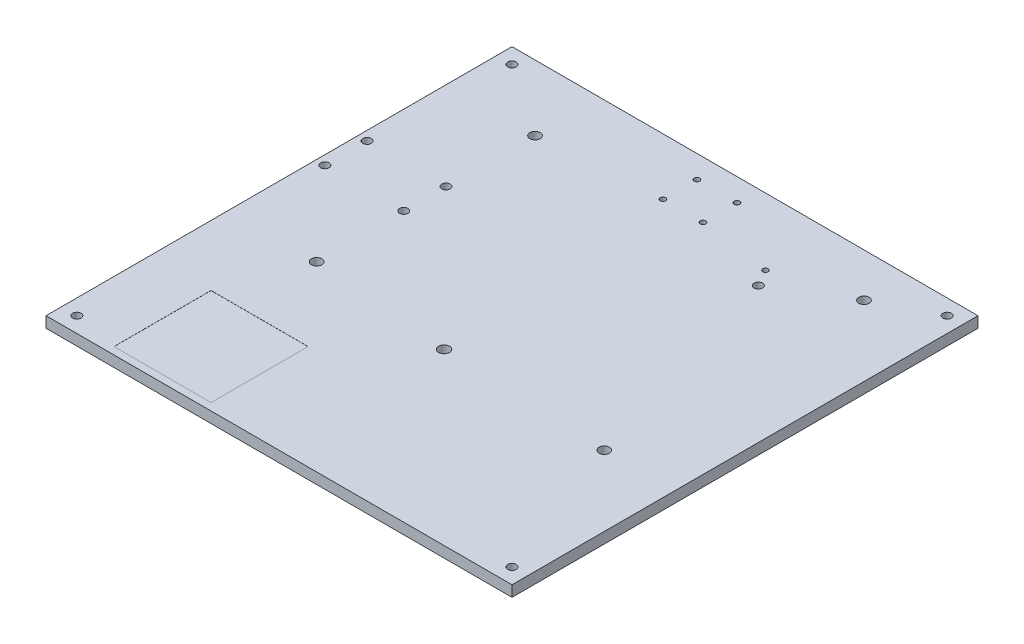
SolidWorks part; units mm, degrees
ref_plane "Front Plane" through (0, 0, 0) normal (0, 0, 1) x (1, 0, 0)
ref_plane "Top Plane" through (0, 0, 0) normal (0, 1, 0) x (1, 0, 0)
ref_plane "Right Plane" through (0, 0, 0) normal (1, 0, 0) x (0, 0, -1)
sketch "Sketch1" plane through (0, 0, 0) normal (0, 1, 0) x (1, 0, 0)
  line L1 (8.5217, 402.472) -> (392.5217, 402.472)
  line L2 (8.5217, 402.472) -> (8.5217, 18.472)
  line L3 (8.5217, 18.472) -> (392.5217, 18.472)
  line L4 (392.5217, 402.472) -> (392.5217, 18.472)
  circle A3 centre (196.5217, 158.472) radius 4.5
  circle A4 centre (81.5217, 348.472) radius 4.3
  circle A16 centre (334.5217, 152.472) radius 4.3
  circle A17 centre (81.5217, 168.472) radius 4.3
  circle A18 centre (16.0943, 240.6963) radius 3.5
  circle A22 centre (334.5217, 366.472) radius 4.3
  circle A26 centre (280.5217, 333.472) radius 3.5
  circle A27 centre (16.0943, 275.472) radius 3.5
  circle A28 centre (81.0943, 275.472) radius 3.5
  circle A29 centre (81.0943, 240.6963) radius 3.5
  circle A35 centre (21.2217, 389.772) radius 3.5
  circle A36 centre (379.8217, 389.772) radius 3.5
  circle A37 centre (379.8217, 31.172) radius 3.5
  circle A38 centre (21.2217, 31.172) radius 3.5
  circle A39 centre (272.5217, 347.3284) radius 2.2
  circle A40 centre (179.6217, 383.772) radius 2.25 construction
  circle A41 centre (179.6217, 355.772) radius 2.25 construction
  circle A42 centre (212.6217, 355.772) radius 2.25 construction
  circle A56 centre (212.6217, 383.772) radius 2.25 construction
  circle A57 centre (179.6217, 383.772) radius 2.25
  circle A58 centre (179.6217, 355.772) radius 2.25
  circle A59 centre (212.6217, 355.772) radius 2.25
  circle A60 centre (212.6217, 383.772) radius 2.25
  dimension "D5" = 134
  dimension "D3" = 7
  dimension "D4" = 4.5
  dimension "D6" = 7
  dimension "D7" = 8.6
  dimension "D9" = 140
  dimension "D10" = 58
  dimension "D11" = 36
  dimension "D12" = 150
  dimension "D13" = 73
  dimension "D14" = 112
  dimension "D15" = 315
  dimension "D17" = 0
  dimension "D18" = 58
  dimension "D20" = 188
  dimension "D21" = 7
  dimension "D22" = 7
  dimension "D23" = 7
  dimension "D24" = 12.7
  dimension "D25" = 12.7
  dimension "D26" = 12.7
  dimension "D27" = 12.7
  dimension "D28" = 12.7
  dimension "D29" = 12.7
  dimension "D30" = 12.7
  dimension "D19" = 180
  dimension "D33" = 8.6
  dimension "D34" = 8.6
  dimension "D35" = 8.6
  dimension "D36" = 7
  dimension "D37" = 7
  dimension "D38" = 7
  dimension "D39" = 7
  dimension "D40" = 127
  dimension "D41" = 127
  dimension "D42" = 34.7757
  dimension "D44" = 65
  dimension "D45" = 65
  dimension "D46" = 4.4
  dimension "D47" = 16
  dimension "D1" = 384
  dimension "D2" = 384
  dimension "D31" = 12.7
  dimension "D43" = 34.7757
  dimension "D48" = 8
extrude "Boss-Extrude1" add sketch "Sketch1" along normal blind 9 contours L2 L3 L4 L1
sketch "Sketch4" plane through (0, 9, 0) normal (0, 1, 0) x (1, 0, 0)
  line L0 (8.5217, 402.472) -> (58.5217, 402.472) construction
  line L1 (8.5217, 18.472) -> (392.5217, 18.472)
  line L3 (138.5217, 24.472) -> (138.5217, 104.472)
  line L4 (138.5217, 104.472) -> (58.5217, 104.472)
  line L5 (58.5217, 104.472) -> (58.5217, 24.472)
  line L6 (58.5217, 24.472) -> (138.5217, 24.472)
  line L7 (392.5217, 402.472) -> (8.5217, 402.472) construction
  line L10 (58.5217, 402.472) -> (58.5217, 104.472) construction
  dimension "D1" = 50
  dimension "D2" = 6
  dimension "D3" = 80
  dimension "D4" = 80
extrude "Cut-Extrude2" cut sketch "Sketch4" against normal blind 0.1
